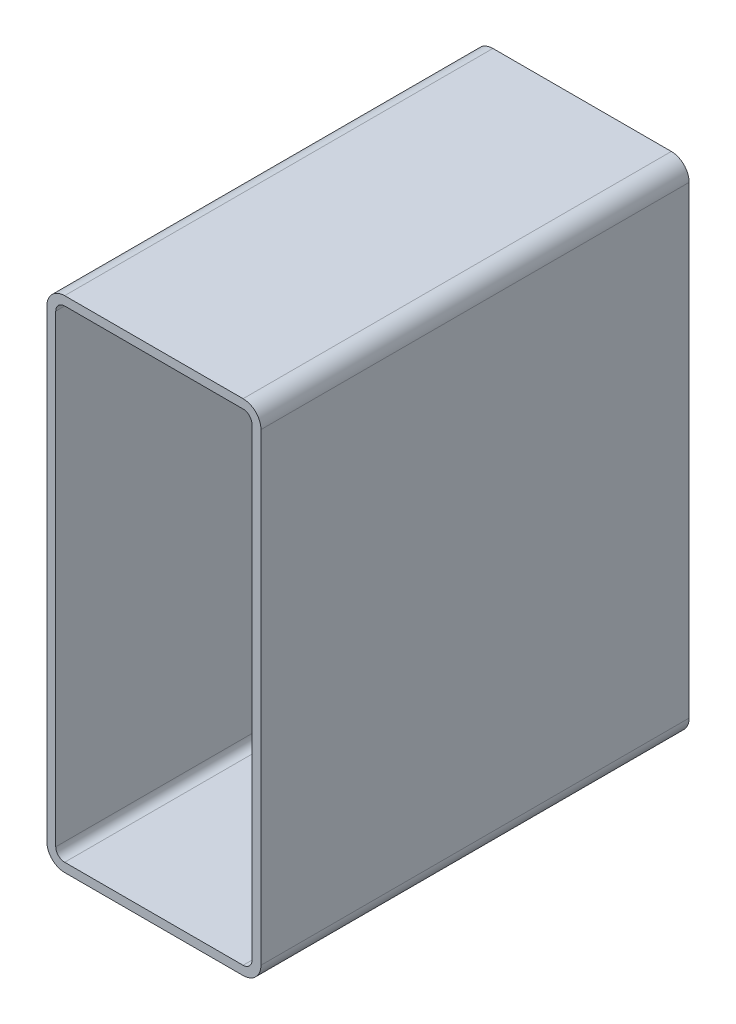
SolidWorks part; units mm, degrees
ref_plane "Front Plane" through (0, 0, 0) normal (0, 0, 1) x (1, 0, 0)
ref_plane "Top Plane" through (0, 0, 0) normal (0, 1, 0) x (1, 0, 0)
ref_plane "Right Plane" through (0, 0, 0) normal (1, 0, 0) x (0, 0, -1)
sketch "Sketch1" plane through (0, 0, 0) normal (0, 0, 1) x (1, 0, 0)
sketch_block_instance "HSS14x6x0.250-1"
sketch_block "HSS14x6x0.250"
extrude "Boss-Extrude1" add sketch "Sketch1" along normal blind 304.8
